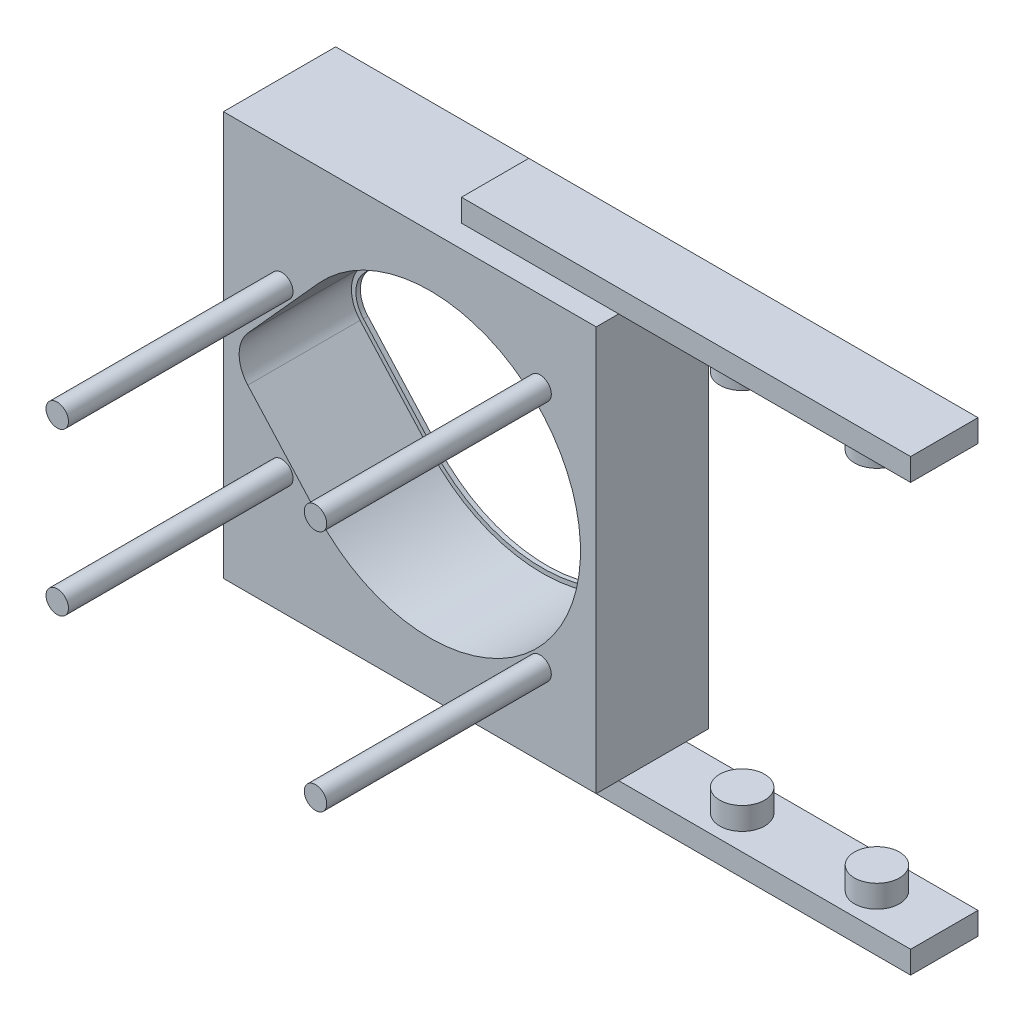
SolidWorks part; units mm, degrees
ref_plane "Face" through (0, 0, 0) normal (0, 0, 1) x (1, 0, 0)
ref_plane "Dessus" through (0, 0, 0) normal (0, 1, 0) x (1, 0, 0)
ref_plane "Droite" through (0, 0, 0) normal (1, 0, 0) x (0, 0, -1)
sketch "Esquisse1" plane through (0, 0, 0) normal (0, 0, 1) x (1, 0, 0)
  line L1 (0, 0) -> (83, 0)
  line L2 (0, 0) -> (0, 90)
  line L3 (0, 90) -> (83, 90)
  line L4 (83, 0) -> (83, 90)
  dimension "D1" = 83
  dimension "D2" = 90
extrude "Base-Extrusion" add sketch "Esquisse1" along normal blind 25
sketch "Esquisse2" plane through (0, 90, 0) normal (0, 1, 0) x (-1, 0, 0)
  line L1 (-48, 5) -> (-148, 5)
  line L2 (-48, 5) -> (-48, 20)
  line L3 (-48, 20) -> (-148, 20)
  line L4 (-148, 5) -> (-148, 20)
  line L6 (0, 25) -> (0, 0) construction
  line L7 (-83, 25) -> (-83, 0) construction
  line L8 (0, 12.5) -> (-113.3805, 12.5) construction
  point P8 (0, 12.5)
  dimension "D1" = 100
  dimension "D2" = 35
  dimension "D3" = 15
extrude "Boss.-Extru.1" add sketch "Esquisse2" along normal blind 5
sketch "Esquisse3" plane through (0, 0, 25) normal (0, 0, 1) x (1, 0, 0)
  line L0 (0, 90) -> (0, 0) construction
  point P0 (0, 45)
ref_plane "Plan1" through (0, 45, 0) normal (0, 1, 0) x (-1, 0, 0)
sketch "Esquisse5" plane through (0, 90, 0) normal (0, -1, 0) x (1, 0, 0)
  line L0 (148, 12.5) -> (73.8092, 12.5) construction
  line L1 (148, 20) -> (148, 5) construction
  circle A0 centre (103, 12.5) radius 5
  circle A1 centre (133, 12.5) radius 5
  dimension "D1" = 10
  dimension "D2" = 30
  dimension "D3" = 15
extrude "Boss.-Extru.2" add sketch "Esquisse5" along normal blind 5
mirror "Symétrie1" about plane through (0, 45, 0) normal (0, 1, 0)
sketch "Esquisse6" plane through (0, 0, 25) normal (0, 0, 1) x (1, 0, 0)
  line L0 (46, 45) -> (0, 45) construction
  line L1 (5.4286, 50.0209) -> (21.1143, 67.4266)
  line L2 (5.4286, 39.9791) -> (21.1143, 22.5734)
  line L3 (0, 90) -> (0, 0) construction
  line L4 (83, 0) -> (83, 90) construction
  arc A0 (21.1143, 22.5734) -> (21.1143, 67.4266) centre (46, 45) ccw
  arc A1 (5.4286, 50.0209) -> (5.4286, 39.9791) centre (11, 45) ccw
  dimension "D1" = 67
  dimension "D2" = 15
  dimension "D3" = 35
  dimension "D4" = 37
extrude "Enlèv. mat.-Extru.1" cut sketch "Esquisse6" against normal through all
sketch "Esquisse7" plane through (0, 0, 25) normal (0, 0, 1) x (1, 0, 0)
  line L0 (0, 45) -> (104.0211, 45) construction
  line L1 (46, 45) -> (46, 108.4986) construction
  circle A0 centre (13, 63) radius 2.5
  circle A1 centre (70.5, 72) radius 2.5
  arc A2 (21.1143, 22.5734) -> (21.1143, 67.4266) centre (46, 45) ccw construction
  circle A3 centre (70.5, 18) radius 2.5
  circle A4 centre (13, 27) radius 2.5
  dimension "D1" = 5
  dimension "D4" = 24.5
  dimension "D5" = 33
  dimension "D2" = 27
  dimension "D3" = 18
extrude "Boss.-Extru.3" add sketch "Esquisse7" along normal blind 50
sketch "Esquisse8" plane through (0, 0, 0) normal (0, 0, -1) x (-1, 0, 0)
  line L4 (-20.3714, 21.904) -> (-4.6857, 39.3097)
  line L5 (-4.6857, 50.6903) -> (-20.3714, 68.096)
  line L6 (-20.3714, 21.904) -> (-4.6857, 39.3097)
  line L7 (-4.6857, 50.6903) -> (-20.3714, 68.096)
  line L10 (-21.8571, 23.2429) -> (-6.1714, 40.6486)
  line L11 (-6.1714, 49.3514) -> (-21.8571, 66.7571)
  line L12 (-21.8571, 23.2429) -> (-6.1714, 40.6486)
  line L13 (-6.1714, 49.3514) -> (-21.8571, 66.7571)
  arc A4 (-4.6857, 39.3097) -> (-4.6857, 50.6903) centre (-11, 45) ccw
  arc A5 (-20.3714, 68.096) -> (-20.3714, 21.904) centre (-46, 45) ccw
  arc A6 (-4.6857, 39.3097) -> (-4.6857, 50.6903) centre (-11, 45) ccw
  arc A7 (-20.3714, 68.096) -> (-20.3714, 21.904) centre (-46, 45) ccw
  arc A10 (-21.8571, 66.7571) -> (-21.8571, 23.2429) centre (-46, 45) ccw
  arc A11 (-21.8571, 66.7571) -> (-21.8571, 23.2429) centre (-46, 45) ccw
  arc A12 (-6.1714, 40.6486) -> (-6.1714, 49.3514) centre (-11, 45) ccw
  arc A13 (-6.1714, 40.6486) -> (-6.1714, 49.3514) centre (-11, 45) ccw
  dimension "D1" = 1
  dimension "D2" = 1
extrude "Boss.-Extru.4" add sketch "Esquisse8" along normal blind 1
